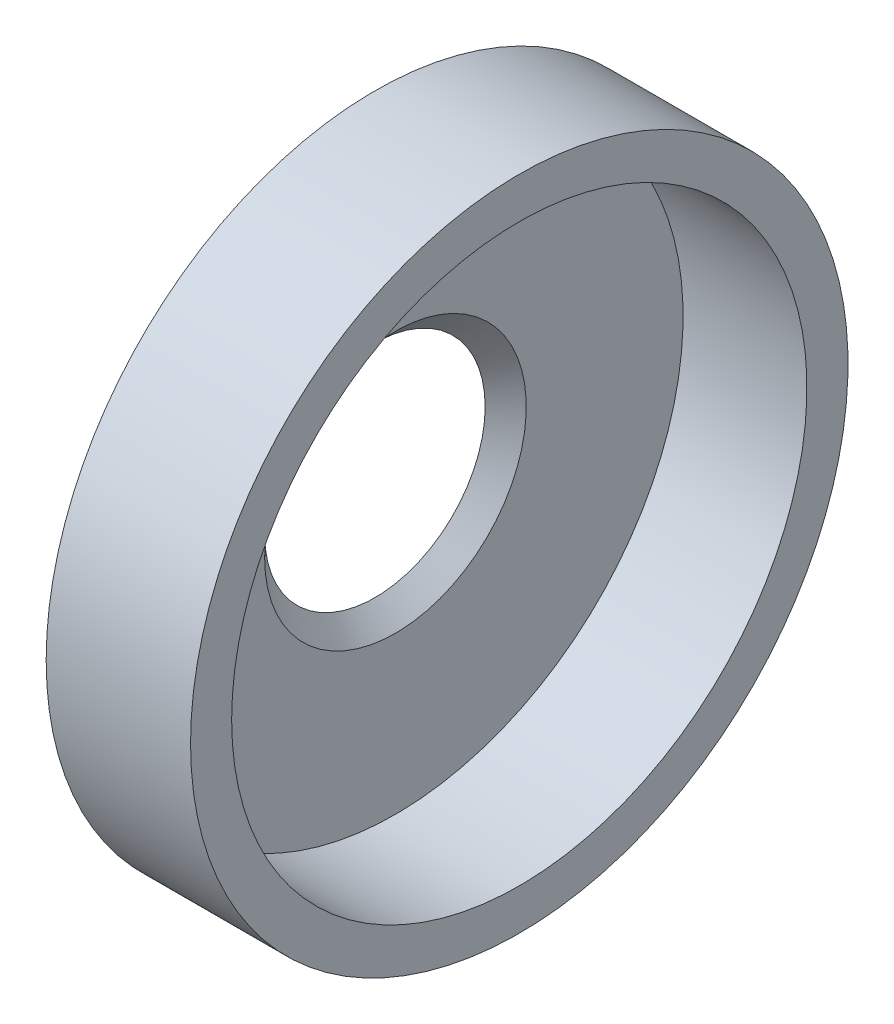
SolidWorks part; units mm, degrees
ref_plane "Front Plane" through (0, 0, 0) normal (0, 0, 1) x (1, 0, 0)
ref_plane "Top Plane" through (0, 0, 0) normal (0, 1, 0) x (1, 0, 0)
ref_plane "Right Plane" through (0, 0, 0) normal (1, 0, 0) x (0, 0, -1)
sketch "Sketch1" plane through (0, 0, 0) normal (0, 0, 1) x (1, 0, 0)
  line L0 (0, 0) -> (70.9939, 0) construction
  line L1 (0, 4.26) -> (0.7938, 5.0538)
  line L2 (5.5778, 12.7) -> (5.5778, 11.1125)
  line L3 (5.5778, 12.7) -> (0, 12.7)
  line L4 (0, 12.7) -> (0, 4.26)
  line L5 (5.5778, 11.1125) -> (0.7938, 11.1125)
  line L6 (0.7938, 11.1125) -> (0.7938, 5.0538)
  dimension "D1" = 4.26
  dimension "D2" = 11.1125
  dimension "D3" = 1.5875
  dimension "D4" = 0.7937
  dimension "D5" = 45
  dimension "D6" = 5.5778
revolve "Revolve1" add sketch "Sketch1" angle 360 about L0
